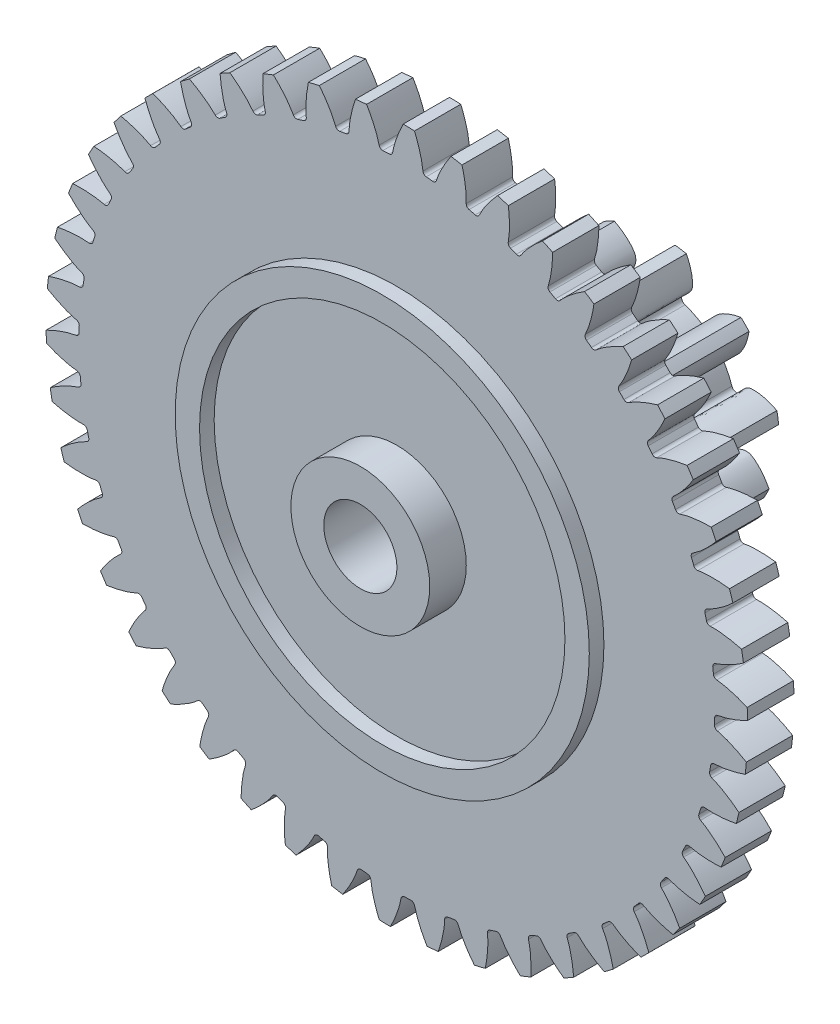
SolidWorks part; units mm, degrees
ref_plane "Face" through (0, 0, 0) normal (0, 0, 1) x (1, 0, 0)
ref_plane "Dessus" through (0, 0, 0) normal (0, 1, 0) x (1, 0, 0)
ref_plane "Droite" through (0, 0, 0) normal (1, 0, 0) x (0, 0, -1)
other "Joindre1"
other "Roue Z2 m=0,3 Z=46<1>@Z2-Z3"
other "Roue Z3 m=0,4 Z=10<2>@Z2-Z3"
sketch "Dp" plane through (0, 0, 0) normal (0, 0, 1) x (1, 0, 0)
  circle A0 centre (0, 0) radius 6.9 construction
  circle A1 centre (0, 0) radius 1.5 construction
  dimension "D1" = 13.8
  dimension "D2" = 3
